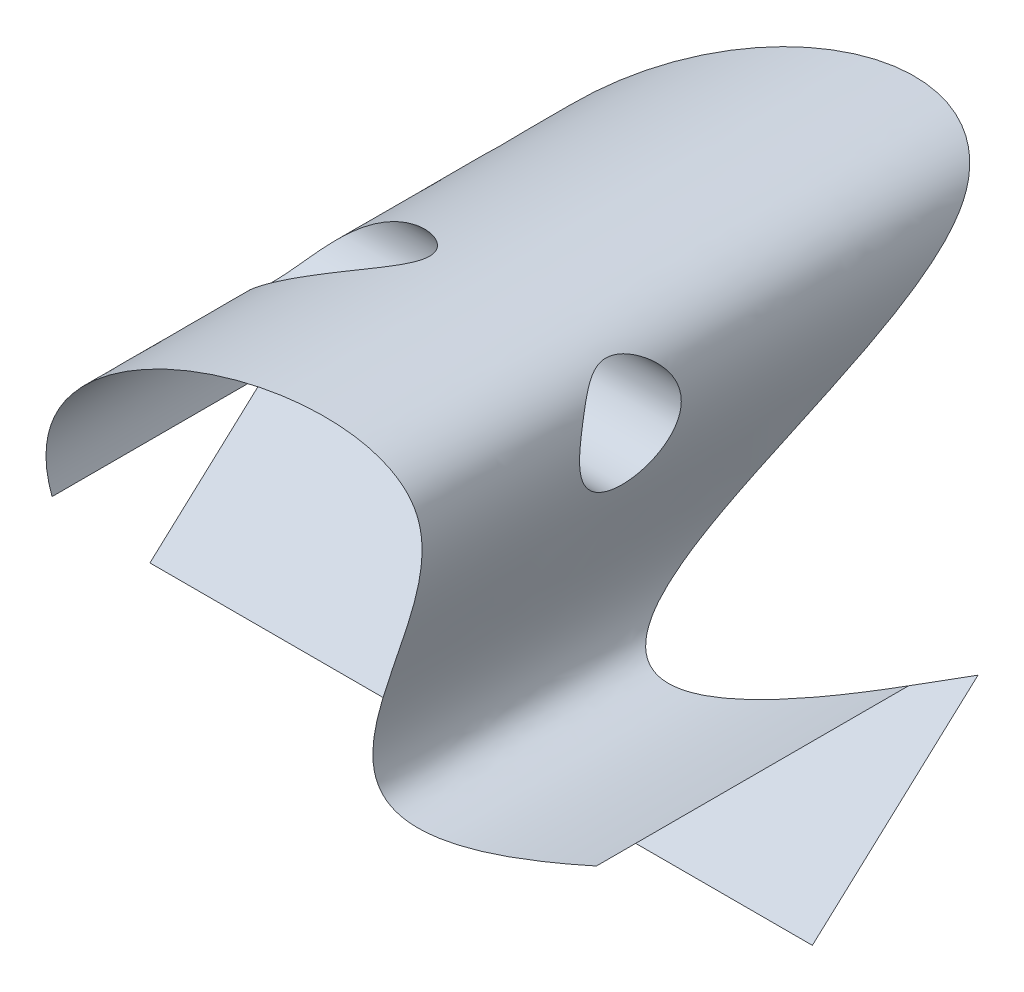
SolidWorks part; units mm, degrees
ref_plane "Front Plane" through (0, 0, 0) normal (0, 0, 1) x (1, 0, 0)
ref_plane "Top Plane" through (0, 0, 0) normal (0, 1, 0) x (1, 0, 0)
ref_plane "Right Plane" through (0, 0, 0) normal (1, 0, 0) x (0, 0, -1)
sketch "Sketch1" plane through (0, 0, 0) normal (0, 0, 1) x (1, 0, 0)
  spline S0 degree 3 poles (-84.2134, -23.6341) (-103.0836, 26.848) (136.3153, 98.7207) (-35.8834, -96.9735) (92.3631, -39.1185) knots 0 0 0 0 0.513155 1 1 1 1
surface "Surface-Extrude1" sketch "Sketch1" parameters "D1"=214.884
sketch "Sketch2" plane through (0, 0, 0) normal (1, 0, 0) x (0, 0, -1)
  line L0 (227.6919, 76.2692) -> (54.9778, -81.3556)
surface "Surface-Extrude2" sketch "Sketch2" parameters "D1"=214.884
sketch "Sketch3" plane through (0, 0, 0) normal (1, 0, 0) x (0, 0, -1)
  circle A0 centre (67.6019, 21.0708) radius 16.4934
surface "Surface-Extrude3" sketch "Sketch3" parameters "D1"=177.292
surface "Surface-Trim4"
surface "Surface-Trim5"
surface "Surface-Trim6"
surface "Surface-Trim7"
surface "Surface-Knit1"
surface "Surface-Knit2"
